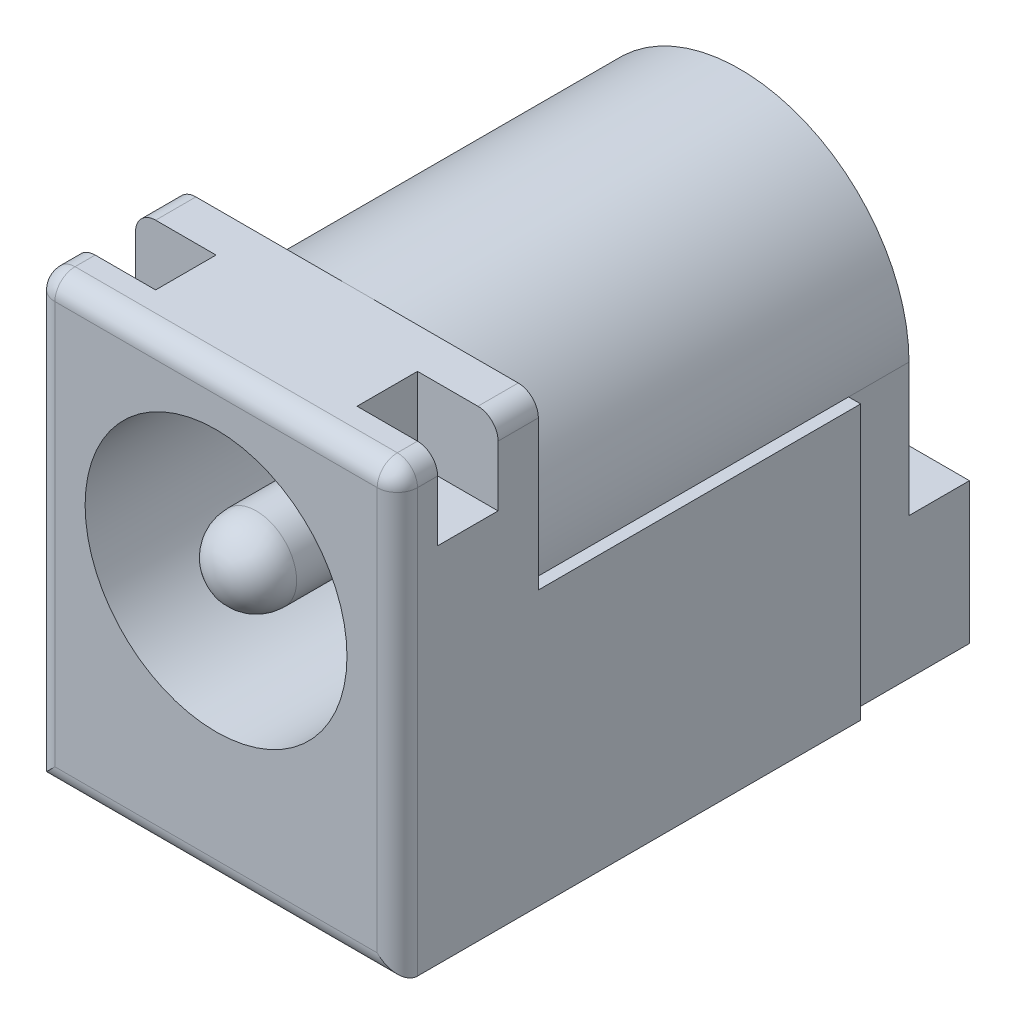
SolidWorks part; units mm, degrees
ref_plane "Front Plane" through (0, 0, 0) normal (0, 0, 1) x (1, 0, 0)
ref_plane "Top Plane" through (0, 0, 0) normal (0, 1, 0) x (1, 0, 0)
ref_plane "Right Plane" through (0, 0, 0) normal (1, 0, 0) x (0, 0, -1)
sketch "Sketch1" plane through (0, 0, 0) normal (0, 0, 1) x (1, 0, 0)
  line L1 (-4.5, 5.5) -> (4.5, 5.5)
  line L2 (-4.5, 5.5) -> (-4.5, -5.5)
  line L3 (-4.5, -5.5) -> (4.5, -5.5)
  line L4 (4.5, 5.5) -> (4.5, -5.5)
  line L5 (-4.5, 5.5) -> (4.5, -5.5) construction
  line L6 (-4.5, -5.5) -> (4.5, 5.5) construction
  point P0 (0, 0)
  dimension "D1" = 9
  dimension "D2" = 11
extrude "Boss-Extrude1" add sketch "Sketch1" against normal blind 14.5
sketch "Sketch2" plane through (0, 0, -14.5) normal (0, 0, -1) x (-1, 0, 0)
  line L0 (-4.2, 1.3) -> (4.2, 1.3)
  line L4 (4.5, 5.5) -> (4.5, -5.5) construction
  line L5 (-4.5, 5.5) -> (4.5, 5.5) construction
  line L6 (-4.2, 1.3) -> (-4.5, 1.3)
  line L7 (-4.5, -5.5) -> (-4.5, 5.5) construction
  line L8 (4.2, 1.3) -> (4.5, 1.3)
  arc A0 (-4.2, 1.3) -> (4.2, 1.3) centre (0, 1.3) cw
  dimension "D2" = 0.3
extrude "Cut-Extrude3" cut sketch "Sketch2" against normal blind 11 contours L6 A0 M6 M3 | A0 L8 M6 M5
sketch "Sketch3" plane through (4.5, 0, 0) normal (1, 0, 0) x (0, 0, -1)
  line L0 (14.5, -5.5) -> (14.5, 1.3)
  line L1 (14.5, -5.5) -> (14.5, 1.3) construction
  line L4 (3.5, 1.3) -> (14.5, 1.3) construction
  line L5 (14.5, 1.3) -> (11.5, 1.3)
  line L6 (11.5, 1.3) -> (11.5, -5.5)
  line L7 (14.5, -5.5) -> (0, -5.5) construction
  line L8 (11.5, -5.5) -> (14.5, -5.5)
  point P6 (14.5, 1.3)
  point P13 (14.5, 1.2425)
  dimension "D1" = 3
extrude "Cut-Extrude4" cut sketch "Sketch3" against normal blind 0.3
mirror "Mirror1" about plane through (0, 0, 0) normal (1, 0, 0) of "Cut-Extrude4"
sketch "Sketch5" plane through (4.2, 0, 0) normal (1, 0, 0) x (0, 0, -1)
  line L0 (14.5, -5.5) -> (14.5, 1.3) construction
  line L1 (14.5, -2) -> (13, -2)
  line L2 (14.5, -2) -> (14.5, 5.5)
  line L3 (14.5, 5.5) -> (13, 5.5)
  line L4 (13, -2) -> (13, 5.5)
  line L5 (14.5, 5.5) -> (3.5, 5.5) construction
  line L6 (11.5, 1.3) -> (11.5, -5.5) construction
  line L7 (11.5, -5.5) -> (14.5, -5.5) construction
  dimension "D1" = 1.5
  dimension "D2" = 3.5
extrude "Cut-Extrude5" cut sketch "Sketch5" against normal through all
sketch "Sketch6" plane through (0, 0, -14.5) normal (0, 0, -1) x (-1, 0, 0)
  line L0 (4.2, -5.5) -> (-4.2, -5.5) construction
  line L1 (-1.75, -5.5) -> (1.75, -5.5)
  line L2 (-1.75, -5.5) -> (-1.75, -2)
  line L3 (-1.75, -2) -> (1.75, -2)
  line L4 (1.75, -5.5) -> (1.75, -2)
  line L5 (4.2, -2) -> (-4.2, -2) construction
  point P8 (0, -5.5)
  point P9 (0, -2)
  dimension "D1" = 3.5
extrude "Cut-Extrude6" cut sketch "Sketch6" against normal up to surface (1.5 mm away)
sketch "Sketch7" plane through (0, 0, -13) normal (0, 0, -1) x (-1, 0, 0)
  line L0 (0, 1.3) -> (0, -7.5) construction
  line L1 (1.5, 1.3) -> (1.5, -7.5)
  line L2 (-1.5, 1.3) -> (-1.5, -7.5)
  line L4 (-4.5891, -9) -> (7.0324, -9) construction
  line L5 (4.2, -5.5) -> (1.75, -5.5) construction
  line L6 (-1.5, 1.3) -> (1.5, 1.3) construction
  line L7 (4.2, 1.3) -> (4.5, 1.3) construction
  arc A0 (1.5, 1.3) -> (-1.5, 1.3) centre (0, 1.3) ccw
  arc A1 (-1.5, -7.5) -> (1.5, -7.5) centre (0, -7.5) ccw
  point P2 (0, -3.1)
  dimension "D2" = 3.5
  dimension "D1" = 3
extrude "Boss-Extrude2" add sketch "Sketch7" along normal blind 0.5
sketch "Sketch8" plane through (0, 0, -13.5) normal (0, 0, -1) x (-1, 0, 0)
  circle A0 centre (0, 1.3) radius 1.375
  circle A2 centre (0, 1.3) radius 1
  dimension "D1" = 2.75
  dimension "D2" = 2
extrude "Boss-Extrude3" add sketch "Sketch8" along normal blind 0.5 contours A0 A2
chamfer "Chamfer1" distance 0.5 angle 45 1 edges at (-1.375, 1.3, -14)
sketch "Sketch9" plane through (0, -5.5, 0) normal (0, -1, 0) x (1, 0, 0)
  line L0 (0, 0) -> (0, -13) construction
  line L1 (-1.25, -7) -> (1.25, -7)
  line L2 (-1.25, -7) -> (-1.25, -7.5)
  line L3 (-1.25, -7.5) -> (1.25, -7.5)
  line L4 (1.25, -7) -> (1.25, -7.5)
  line L5 (1.5, -13) -> (-1.5, -13) construction
  line L6 (-1.25, -7.5) -> (1.25, -7) construction
  point P9 (0, -7.25)
  point P10 (0, -7)
  dimension "D1" = 0.5
  dimension "D2" = 2.5
  dimension "D3" = 5.75
extrude "Boss-Extrude4" add sketch "Sketch9" along normal blind 6
sketch "Sketch10" plane through (0, 0, -7) normal (0, 0, 1) x (1, 0, 0)
  line L0 (-1.25, -11.5) -> (-1.25, -5.5) construction
  line L1 (1.25, -11.5) -> (1.25, -5.5) construction
  line L2 (-1.0662, -9) -> (1.0355, -9) construction
  line L3 (-4.5, -5.5) -> (4.5, -5.5) construction
  line L4 (-1.25, -8.3292) -> (1.25, -8.3292)
  arc A1 (-1.25, -8.3292) -> (1.25, -8.3292) centre (0, -7.5) ccw
  point P11 (0, 0)
  point P12 (0, -7.5)
  dimension "D1" = 1.5
  dimension "D2" = 3.5
extrude "Cut-Extrude8" cut sketch "Sketch10" against normal blind 0.5
sketch "Sketch11" plane through (0, 0, -13.5) normal (0, 0, -1) x (-1, 0, 0)
  circle A0 centre (0, -7.5) radius 0.6
  dimension "D1" = 1.2
extrude "Cut-Extrude9" cut sketch "Sketch11" against normal through all
sketch "Sketch12" plane through (4.5, 0, 0) normal (1, 0, 0) x (0, 0, -1)
  line L0 (3.5, 5.5) -> (0, 5.5) construction
  line L1 (1, 5.5) -> (2.5, 5.5)
  line L2 (1, 5.5) -> (1, 3.5)
  line L3 (1, 3.5) -> (2.5, 3.5)
  line L4 (2.5, 5.5) -> (2.5, 3.5)
  line L5 (1, 4.7806) -> (0, 4.7806) construction
  line L6 (0, -5.5) -> (0, 5.5) construction
  line L7 (2.5, 4.7806) -> (3.5, 4.7806) construction
  line L8 (3.5, 5.5) -> (3.5, 1.3) construction
  dimension "D1" = 1.5
  dimension "D2" = 2
extrude "Cut-Extrude10" cut sketch "Sketch12" against normal blind 2
mirror "Mirror2" about plane through (0, 0, 0) normal (1, 0, 0) of "Cut-Extrude10"
sketch "Sketch13" plane through (0, 0, 0) normal (0, 0, 1) x (1, 0, 0)
  line L0 (-4.5, -5.5) -> (4.5, -5.5) construction
  circle A0 centre (0, 1) radius 3.25
  circle A1 centre (0, 1) radius 1
  dimension "D1" = 6.5
  dimension "D2" = 6.5
  dimension "D3" = 2
extrude "Cut-Extrude11" cut sketch "Sketch13" against normal blind 12 contours A0 A1
fillet "Fillet1" radius 1 1 edges at (1, 1, 0)
fillet "Fillet2" radius 0.5 8 edges at (-4.5, 5.5, -0.5) (-4.5, 5.5, -3) (4.5, 5.5, -0.5) (4.5, 5.5, -3) (0, -5.5, 0) (0, 5.5, 0) (-4.5, 0, 0) (4.5, 0, 0)
